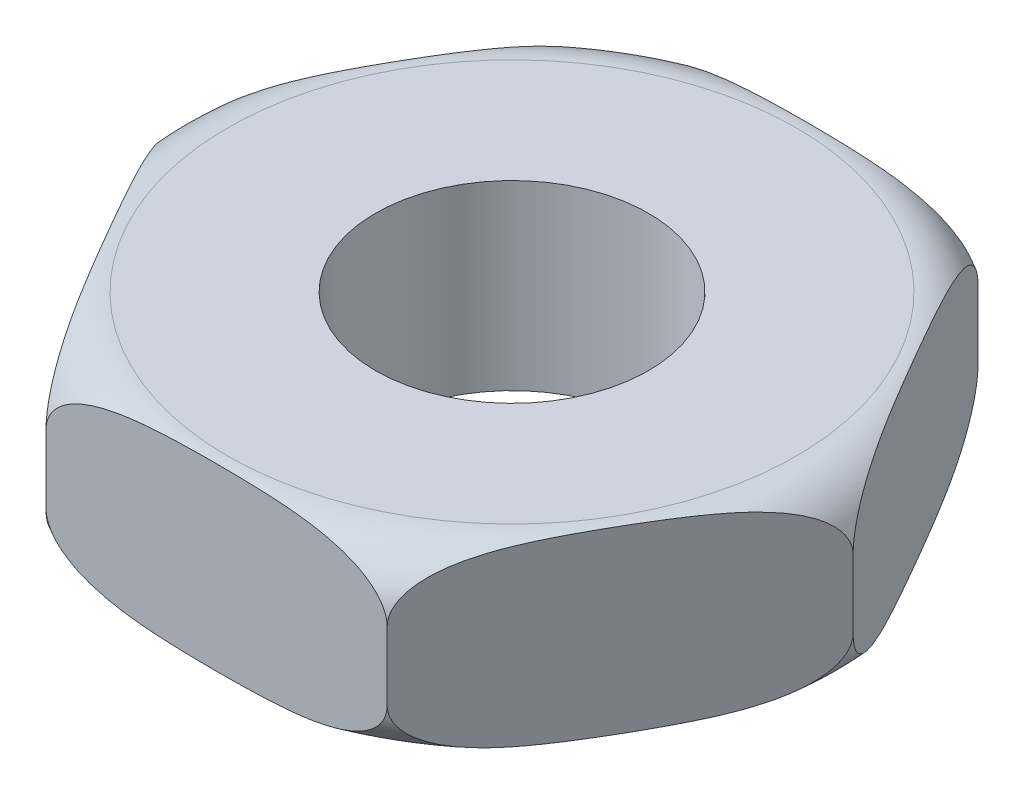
SolidWorks part; units mm, degrees
ref_plane "Front" through (0, 0, 0) normal (0, 0, 1) x (1, 0, 0)
ref_plane "Top" through (0, 0, 0) normal (0, 1, 0) x (1, 0, 0)
ref_plane "Right" through (0, 0, 0) normal (1, 0, 0) x (0, 0, -1)
sketch "Sketch1" plane through (0, 0, 0) normal (0, 1, 0) x (1, 0, 0)
  line L1 (15, 0) -> (7.5, 12.9904)
  line L2 (7.5, 12.9904) -> (-7.5, 12.9904)
  line L3 (-7.5, 12.9904) -> (-15, 0)
  line L4 (-15, 0) -> (-7.5, -12.9904)
  line L5 (-7.5, -12.9904) -> (7.5, -12.9904)
  line L6 (7.5, -12.9904) -> (15, 0)
  circle A0 centre (0, 0) radius 12.9904 construction
  circle A1 centre (0, 0) radius 6
  dimension "D2" = 12
  dimension "D1" = 30
extrude "Extrude1" add sketch "Sketch1" along normal mid plane 8
sketch "Sketch2" plane through (0, 0, 0) normal (0, 0, 1) x (1, 0, 0)
  line L0 (0, 5.1986) -> (0, -6.5373) construction
  line L3 (12.5, 4) -> (12.5, 5.9572)
  line L4 (12.5, 5.9572) -> (12.8705, 5.9572)
  line L5 (7.5, 4) -> (15, 4) construction
  line L6 (12.8705, 5.9572) -> (16.3989, 5.9572)
  line L7 (16.3989, 5.9572) -> (16.3989, 1.5)
  line L8 (16.3989, 1.5) -> (15, 1.5)
  line L9 (15, 4) -> (15, -4) construction
  line L10 (-17.1345, 0) -> (21.7448, 0) construction
  line L11 (16.3989, -1.5) -> (15, -1.5)
  line L12 (16.3989, -5.9572) -> (16.3989, -1.5)
  line L13 (12.8705, -5.9572) -> (16.3989, -5.9572)
  line L14 (12.5, -5.9572) -> (12.8705, -5.9572)
  line L15 (12.5, -4) -> (12.5, -5.9572)
  arc A0 (15, 1.5) -> (12.5, 4) centre (12.5, 1.5) ccw
  arc A1 (15, -1.5) -> (12.5, -4) centre (12.5, -1.5) cw
  dimension "D1" = 2.5
revolve "Cut-Revolve1" cut sketch "Sketch2" angle 360 about L0
